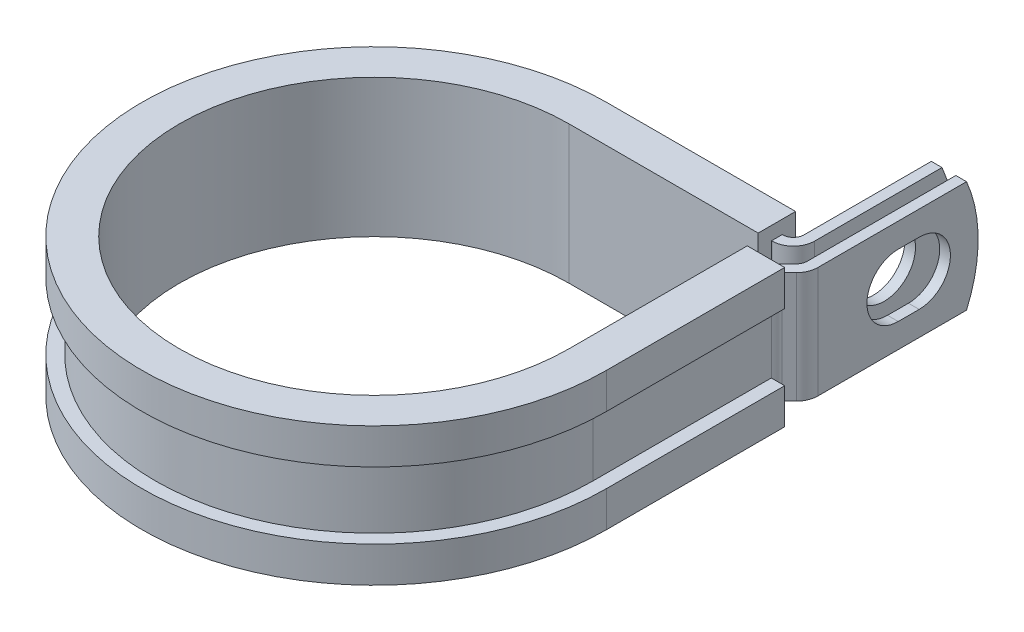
SolidWorks part; units mm, degrees
ref_plane "Front Plane" through (0, 0, 0) normal (0, 0, 1) x (1, 0, 0)
ref_plane "Top Plane" through (0, 0, 0) normal (0, 1, 0) x (1, 0, 0)
ref_plane "Right Plane" through (0, 0, 0) normal (1, 0, 0) x (0, 0, -1)
sketch "Sketch1" plane through (0, 0, 0) normal (0, 1, 0) x (1, 0, 0)
  line L0 (0, 23.749) -> (21.6333, 23.749)
  line L1 (23.749, 0) -> (23.749, 20.3365)
  line L2 (24.0717, 42.037) -> (24.0717, 26.1874)
  line L3 (24.4632, 22.0607) -> (25.2894, 22.8869)
  line L5 (25.6465, 23.749) -> (25.6465, 42.037)
  arc A0 (0, 23.749) -> (23.749, 0) centre (0, 0) ccw
  arc A1 (24.4632, 22.0607) -> (23.749, 20.3365) centre (26.1874, 20.3365) ccw
  arc A2 (25.2894, 22.8869) -> (25.6465, 23.749) centre (24.4273, 23.749) ccw
  arc A3 (21.6333, 23.749) -> (24.0717, 26.1874) centre (21.6333, 26.1874) ccw
extrude "Extrude-Thin1" add sketch "Sketch1" along normal mid plane 12.7 thin
sketch "Sketch2" plane through (22.8525, 0, 0) normal (-1, 0, 0) x (0, 0, 1)
  line L0 (-42.037, 6.35) -> (-42.037, -6.35) construction
  line L1 (0, 6.35) -> (0, -6.35) construction
  circle A0 centre (-34.1122, 0) radius 3.5687
  point P2 (-42.037, 0)
extrude "Cut-Extrude1" cut sketch "Sketch2" against normal up to surface (1.2192 mm away)
sketch "Sketch3" plane through (26.8657, 0, 0) normal (1, 0, 0) x (0, 0, -1)
  line L0 (32.9184, 0) -> (35.306, 0) construction
  line L1 (32.9184, 3.5687) -> (35.306, 3.5687)
  line L2 (32.9184, -3.5687) -> (35.306, -3.5687)
  line L3 (42.037, 6.35) -> (42.037, -6.35) construction
  arc A0 (32.9184, 3.5687) -> (32.9184, -3.5687) centre (32.9184, 0) ccw
  arc A1 (35.306, -3.5687) -> (35.306, 3.5687) centre (35.306, 0) ccw
  point P3 (34.1122, 0)
  point P8 (42.037, 0)
  point P11 (29.3497, 0)
  point P12 (38.8747, 0)
extrude "Cut-Extrude2" cut sketch "Sketch3" against normal up to surface (1.2192 mm away)
sketch "Sketch4" plane through (22.8525, 0, 0) normal (-1, 0, 0) x (0, 0, 1)
  line L0 (-42.037, 6.35) -> (-42.037, -6.35)
  line L1 (-42.037, 6.35) -> (-40.7117, 6.35)
  line L2 (-42.037, 6.35) -> (-26.1874, 6.35) construction
  line L3 (-42.037, -6.35) -> (-40.7117, -6.35)
  line L4 (-42.037, -6.35) -> (-26.1874, -6.35) construction
  arc A0 (-40.7117, 6.35) -> (-40.7117, -6.35) centre (-26.162, 0) ccw
extrude "Cut-Extrude3" cut sketch "Sketch4" against normal through all contours A0 M4 M5 | A0 L0 M2
ref_plane "Plane1" through (0, 0, -20.3365) normal (0, 0, -1) x (-1, 0, 0)
ref_plane "Plane2" through (21.5825, 0, 0) normal (-1, 0, 0) x (0, 0, 1)
sketch "Sketch5" plane through (0, 0, -20.3365) normal (0, 0, -1) x (-1, 0, 0)
  line L0 (-24.9682, 6.35) -> (-23.749, 6.35)
  line L1 (-24.9682, 6.35) -> (-24.9682, -6.35) construction
  line L3 (-23.749, 6.35) -> (-23.749, -6.35)
  line L4 (-23.749, -6.35) -> (-24.9682, -6.35)
  line L5 (-24.9682, -6.35) -> (-24.9682, -3.81)
  line L6 (-24.9682, 6.35) -> (-24.9682, 3.81)
  line L7 (-26.4922, 7.874) -> (-26.4922, 3.81)
  line L8 (-26.4922, 7.874) -> (-22.225, 7.874)
  line L9 (-22.225, 7.874) -> (-22.225, -7.874)
  line L10 (-22.225, -7.874) -> (-26.4922, -7.874)
  line L11 (-26.4922, -7.874) -> (-26.4922, -3.81)
  line L12 (-26.4922, 3.81) -> (-24.9682, 3.81)
  line L13 (-24.9682, -3.81) -> (-26.4922, -3.81)
sketch "Sketch6" plane through (0, 6.35, 0) normal (0, 1, 0) x (1, 0, 0)
  line L0 (22.225, 0) -> (22.225, 20.3365)
  line L1 (22.225, 20.3365) -> (26.4922, 20.3365) construction
  line L2 (21.5825, 6.9878) -> (21.5825, -6.9878) construction
  line L5 (0, 22.225) -> (21.5825, 22.225)
  arc A0 (0, 22.225) -> (22.225, 0) centre (0, 0) ccw
sweep "Sweep1" add profiles "Sketch5" path "Sketch6"
equation "\"D4@Sketch5\" = \"D1@Extrude-Thin1\""
equation "\"D5@Sketch5\" = \"D5@Extrude-Thin1\""
equation "\"D1@Sketch3\" = \"D2@Sketch2\""
equation "\"D7@Sketch1\" = \"D3@Sketch2\" + \"D1@Sketch3\""
equation "\"D1@Sketch1\" = \"D1@Sketch6\" + 2 * \"D3@Sketch5\""
equation "\"D1@Sketch4\" = ( \"D1@Extrude-Thin1\" + .125 ) * 2"
equation "\"D9@Sketch1\"= \"D5@Extrude-Thin1\""
equation "\"D8@Sketch1\"= 2 * \"D5@Extrude-Thin1\""
equation "\"D2@Sketch1\" = 2 * \"D5@Extrude-Thin1\""
equation "\"D2@Sketch3\" = \"D1@Sketch2\""
